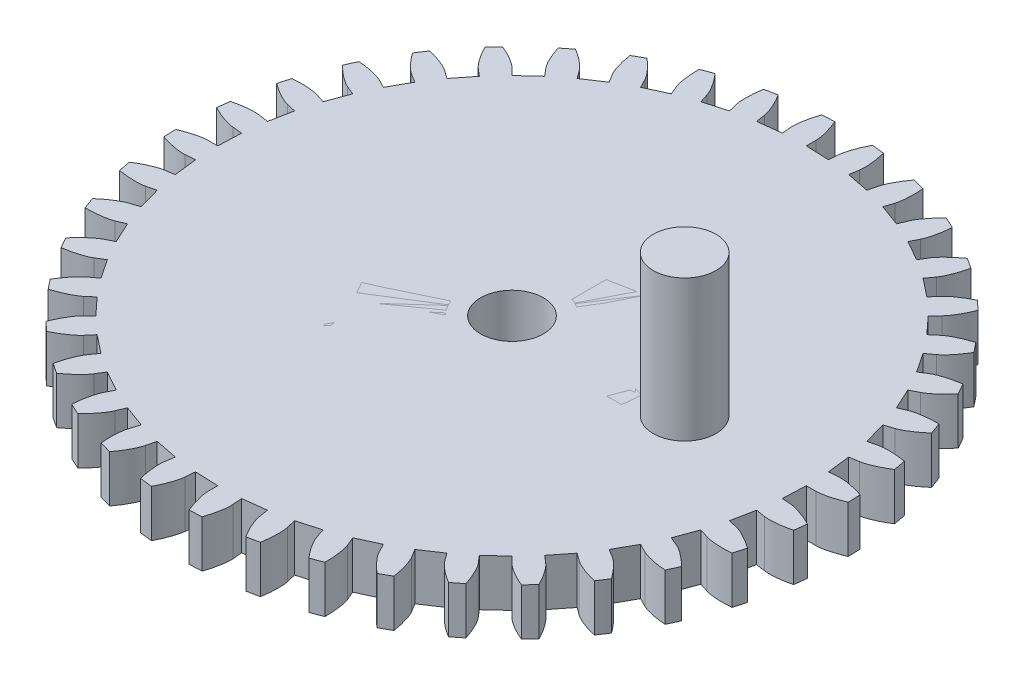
SolidWorks part; units mm, degrees
ref_plane "Front Plane" through (0, 0, 0) normal (0, 0, 1) x (1, 0, 0)
ref_plane "Top Plane" through (0, 0, 0) normal (0, 1, 0) x (1, 0, 0)
ref_plane "Right Plane" through (0, 0, 0) normal (1, 0, 0) x (0, 0, -1)
sketch "Sketch1" plane through (0, 0, 0) normal (0, 1, 0) x (1, 0, 0)
  line L0 (0, 0) -> (0, 9.6815) construction
  line L1 (0, 0) -> (-9.6815, 0) construction
  line L2 (0, 0) -> (-10.4919, -0.4122) construction
  line L3 (0, 0) -> (-9.6516, -0.7596) construction
  line L4 (0, 0) -> (-9.5623, -1.5145) construction
  circle A0 centre (0, 0) radius 10 construction
  circle A1 centre (0, 0) radius 9.6815 construction
  circle A2 centre (0, 0) radius 9.375 construction
  circle A3 centre (0, 0) radius 10.5 construction
  spline S0 degree 4 poles (-9.6815, 0) (-9.6978, 0) (-9.7436, -0.0017) (-9.8299, -0.0115) (-9.9693, -0.0368) (-10.1443, -0.0827) (-10.3662, -0.1574) (-10.6212, -0.2646) (-10.8931, -0.4023) (-11.1787, -0.5725) (-11.4536, -0.7601) (-11.7175, -0.9628) (-11.9704, -1.1789) (-12.2643, -1.4557) (-12.5986, -1.8099) (-12.9609, -2.2506) (-13.3365, -2.7854) (-13.6788, -3.3564) (-13.9817, -3.949) (-14.2463, -4.56) (-14.4449, -5.1071) (-14.5924, -5.5844) (-14.722, -6.0652) (-14.8153, -6.4724) (-14.894, -6.8773) (-14.9588, -7.293) (-15.0019, -7.6142) (-15.0376, -7.9608) (-15.0636, -8.264) (-15.0877, -8.7119) (-15.0947, -8.9809) (-15.0984, -9.4109) (-15.0902, -9.6182) (-15.0869, -9.7968) (-15.0834, -9.845) (-15.0821, -9.8846) knots 0 0 0 0 0 0.005377 0.015084 0.028532 0.04661 0.064855 0.092111 0.119476 0.146842 0.174209 0.201575 0.228941 0.256307 0.307035 0.361767 0.4165 0.471232 0.525964 0.580697 0.635429 0.662795 0.690161 0.744894 0.77226 0.799626 0.826992 0.854358 0.881725 0.909091 0.954545 0.977273 0.988636 1 1 1 1 1 construction
  spline S1 degree 4 poles (-9.6815, 0) (-9.6978, 0) (-9.7436, -0.0017) (-9.8299, -0.0115) (-9.9693, -0.0368) (-10.1443, -0.0827) (-10.3662, -0.1574) (-10.6212, -0.2646) (-10.8931, -0.4023) (-11.1787, -0.5725) (-11.4536, -0.7601) (-11.7175, -0.9628) (-11.9704, -1.1789) (-12.2643, -1.4557) (-12.5986, -1.8099) (-12.9609, -2.2506) (-13.3365, -2.7854) (-13.6788, -3.3564) (-13.9817, -3.949) (-14.2463, -4.56) (-14.4449, -5.1071) (-14.5924, -5.5844) (-14.722, -6.0652) (-14.8153, -6.4724) (-14.894, -6.8773) (-14.9588, -7.293) (-15.0019, -7.6142) (-15.0376, -7.9608) (-15.0636, -8.264) (-15.0791, -8.5523) (-15.0855, -8.7049) (-15.088, -8.7805) knots 0 0 0 0 0 0.005377 0.015084 0.028532 0.04661 0.064855 0.092111 0.119476 0.146842 0.174209 0.201575 0.228941 0.256307 0.307035 0.361767 0.4165 0.471232 0.525964 0.580697 0.635429 0.662795 0.690161 0.744894 0.77226 0.799626 0.826992 0.854358 0.881725 0.909091 0.909091 0.909091 0.909091 0.909091
  dimension "D1" = 21
  dimension "D2" = 20
  dimension "D3" = 19.363
  dimension "D4" = 18.75
  dimension "D5" = 9.6815
  dimension "D6" = 2.25
  dimension "D7" = 4.5
  dimension "D8" = 9
sketch "Sketch2" plane through (0, 0, 0) normal (0, 1, 0) x (1, 0, 0)
  line L0 (0, 0) -> (-10.4919, -0.4122) construction
  line L1 (0, 0) -> (-10.4919, -0.4122) construction
  line L2 (0, 0) -> (-9.6516, -0.7596) construction
  line L3 (0, 0) -> (-9.6815, 0) construction
  line L4 (0, 0) -> (-9.5623, -1.5145) construction
  line L5 (0, 0) -> (-9.6516, -0.7596) construction
  line L6 (0, 0) -> (-9.6815, 0) construction
  line L7 (0, 0) -> (-9.5623, -1.5145) construction
  line L8 (-9.6516, -0.7596) -> (-9.3461, -0.7356)
  line L9 (-9.3461, -0.7356) -> (-9.2596, -1.4666)
  line L10 (-9.2596, -1.4666) -> (-9.5623, -1.5145) construction
  line L11 (-9.2596, -1.4666) -> (-0.9877, -0.1564)
  line L12 (-9.6815, 0) -> (-1, 0)
  circle A0 centre (0, 0) radius 9.375 construction
  circle A1 centre (0, 0) radius 9.6815 construction
  circle A2 centre (0, 0) radius 10 construction
  circle A3 centre (0, 0) radius 10.5 construction
  circle A4 centre (0, 0) radius 9.375 construction
  circle A5 centre (0, 0) radius 9.6815 construction
  circle A6 centre (0, 0) radius 10 construction
  circle A7 centre (0, 0) radius 10.5 construction
  arc A8 (-10.4823, -0.6097) -> (-10.4978, -0.2146) centre (0, 0) cw
  circle A11 centre (0, 0) radius 1 construction
  arc A12 (-1, 0) -> (-0.9877, -0.1564) centre (0, 0) ccw
  spline S0 degree 4 poles (-71.299, -1998.9199) (-6.8473, -37.9907) (-7.2578, -0.7705) (-8.6829, 0.1971) (-9.9693, -0.0368) (-10.1443, -0.0827) (-10.3662, -0.1574) (-10.6212, -0.2646) (-10.8931, -0.4023) (-11.1787, -0.5725) (-11.4536, -0.7601) (-11.7175, -0.9628) (-11.9704, -1.1789) (-12.2643, -1.4557) (-12.5986, -1.8099) (-12.9609, -2.2506) (-13.3365, -2.7854) (-13.6788, -3.3564) (-13.9817, -3.949) (-14.2463, -4.56) (-14.4449, -5.1071) (-14.5924, -5.5844) (-14.722, -6.0652) (-14.8153, -6.4724) (-14.894, -6.8773) (-14.9588, -7.293) (-15.0019, -7.6142) (-15.0376, -7.9608) (-15.18, -9.6199) (-15.1217, -14.1555) (-12.75, 44.3663) (-80.4182, -2007.5727) knots -0.383502 -0.383502 -0.383502 -0.383502 -0.383502 0.005377 0.015084 0.028532 0.04661 0.064855 0.092111 0.119476 0.146842 0.174209 0.201575 0.228941 0.256307 0.307035 0.361767 0.4165 0.471232 0.525964 0.580697 0.635429 0.662795 0.690161 0.744894 0.77226 0.799626 0.826992 0.854358 0.881725 1.398587 1.398587 1.398587 1.398587 1.398587 only from (-9.6815, 0) to (-15.088, -8.7805) construction
  spline S1 degree 4 poles (-9.6815, 0) (-9.6978, 0) (-9.7436, -0.0017) (-9.8299, -0.0115) (-9.9693, -0.0368) (-10.1443, -0.0827) (-10.302, -0.1358) (-10.4189, -0.1814) (-10.4839, -0.2087) (-10.4978, -0.2146) knots 0 0 0 0 0 0.005377 0.015084 0.028532 0.04661 0.064855 0.06982 0.06982 0.06982 0.06982 0.06982
  spline S2 degree 4 poles (-9.6516, -0.7596) (-9.6679, -0.7609) (-9.7137, -0.7628) (-9.8005, -0.7598) (-9.9414, -0.7455) (-10.1195, -0.7134) (-10.2809, -0.6729) (-10.401, -0.6366) (-10.468, -0.6145) (-10.4823, -0.6097) knots 0 0 0 0 0 0.005377 0.015084 0.028532 0.04661 0.064855 0.06982 0.06982 0.06982 0.06982 0.06982
  point P21 (-9.3461, -0.7356)
  point P24 (-9.2596, -1.4666)
  dimension "D2" = 2
extrude "Boss-Extrude1" add sketch "Sketch2" along normal blind 1.5
pattern_circular "CirPattern1" count 40 over 360 of "Boss-Extrude1"
sketch "Sketch3" plane through (0, 1.5, 0) normal (0, 1, 0) x (1, 0, 0)
  line L0 (0, 0) -> (5.5, 0) construction
  circle A0 centre (5.5, 0) radius 1
  dimension "D1" = 2
  dimension "D2" = 5.5
extrude "Boss-Extrude2" add sketch "Sketch3" along normal blind 4.5
equation "\"Module\"= .5"
equation "\"Number of Teeth\"= 40"
equation "\"Pressure Angle\"= 14.5deg"
equation "\"Pitch Diameter\"= \"Number of Teeth\" * \"Module\""
equation "\"Circular Pitch\"= pi * \"Module\""
equation "\"Addendum\"= \"Module\""
equation "\"Dedendum\"= 1.25 * \"Module\""
equation "\"Base Diameter\"= \"Pitch Diameter\" * cos ( \"Pressure Angle\" )"
equation "\"Base Radius\"= \"Base Diameter\" / 2"
equation "\"Width\"= 1.5"
equation "\"Outside Diameter\"= \"Pitch Diameter\" + 2 * \"Addendum\""
equation "\"D1@Sketch1\"=\"Outside Diameter\""
equation "\"D3@Sketch1\"=\"Base Diameter\""
equation "\"Root Diameter\"= \"Pitch Diameter\" - 2 * \"Dedendum\""
equation "\"D4@Sketch1\"=\"Root Diameter\""
equation "\"Tooth Angle\"= 360 / \"Number of Teeth\""
equation "\"D6@Sketch1\"=\"Tooth Angle\"/4"
equation "\"D7@Sketch1\"=\"Tooth Angle\"/2"
equation "\"D8@Sketch1\"=\"Tooth Angle\""
equation "\"D2@Sketch1\" = \"Pitch Diameter\""
equation "\"Shaft Diameter\"= 2"
equation "\"D1@CirPattern1\" = \"Number of Teeth\""
equation "\"D2@Sketch2\"= \"Shaft Diameter\""
equation "\"D1@Boss-Extrude1\" = \"Width\""
